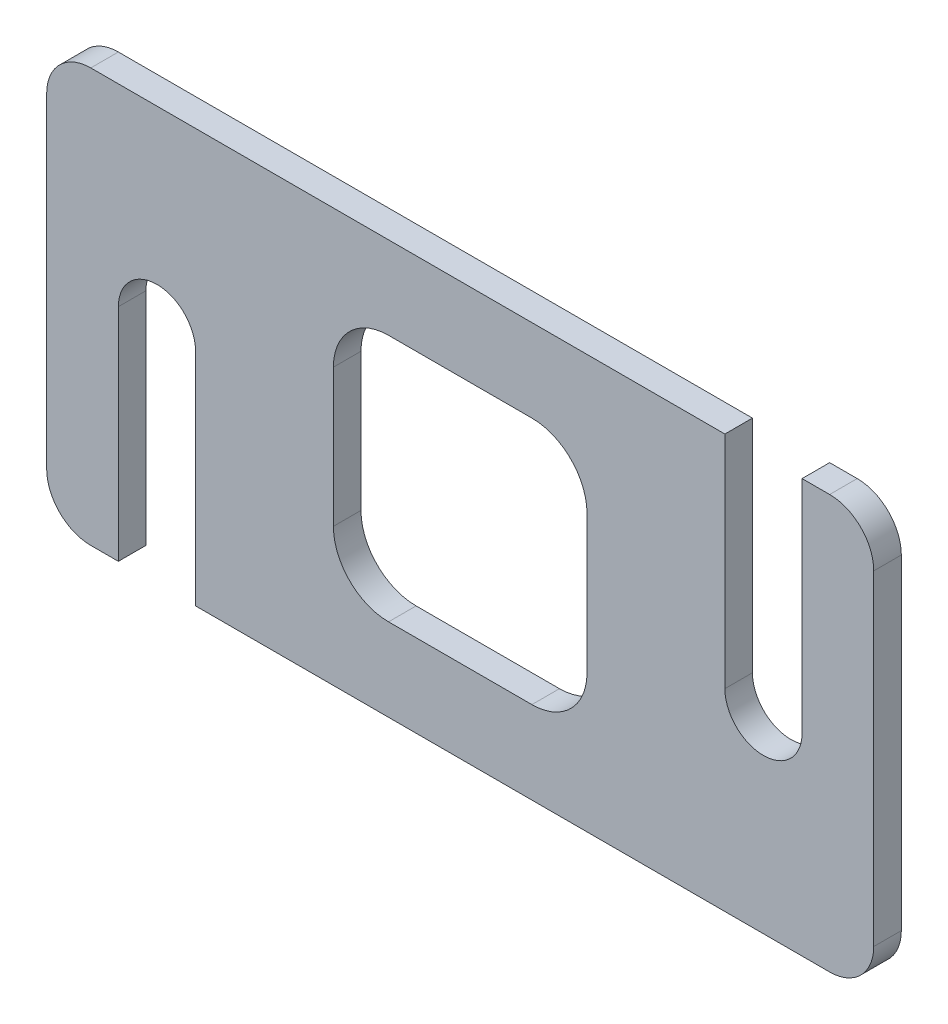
SolidWorks part; units mm, degrees
ref_plane "Front Plane" through (0, 0, 0) normal (0, 0, 1) x (1, 0, 0)
ref_plane "Top Plane" through (0, 0, 0) normal (0, 1, 0) x (1, 0, 0)
ref_plane "Right Plane" through (0, 0, 0) normal (1, 0, 0) x (0, 0, -1)
sketch "Sketch1" plane through (0, 0, 0) normal (0, 0, 1) x (1, 0, 0)
  line L1 (-75, -37.5) -> (75, -37.5)
  line L2 (-75, -37.5) -> (-75, 37.5)
  line L3 (-75, 37.5) -> (75, 37.5)
  line L4 (75, -37.5) -> (75, 37.5)
  line L5 (-75, -37.5) -> (75, 37.5) construction
  line L6 (-75, 37.5) -> (75, -37.5) construction
  point P0 (0, 0)
  dimension "D1" = 150
  dimension "D2" = 75
extrude "Boss-Extrude1" add sketch "Sketch1" along normal blind 5
sketch "Sketch2" plane through (0, 0, 5) normal (0, 0, 1) x (1, 0, 0)
  line L1 (-62, -37.5) -> (-48, -37.5)
  line L2 (-62, -37.5) -> (-62, 2.5)
  line L4 (-48, -37.5) -> (-48, 2.5)
  line L6 (-75, -37.5) -> (75, -37.5) construction
  line L7 (-75, 37.5) -> (-75, -37.5) construction
  arc A0 (-48, 2.5) -> (-62, 2.5) centre (-55, 2.5) ccw
  point P7 (-55, -37.5)
  dimension "D1" = 7
  dimension "D2" = 20
  dimension "D3" = 40
extrude "Cut-Extrude1" cut sketch "Sketch2" against normal through all
sketch "Sketch3" plane through (0, 0, 5) normal (0, 0, 1) x (1, 0, 0)
  line L1 (48, 37.5) -> (62, 37.5)
  line L2 (48, 37.5) -> (48, -2.5)
  line L4 (62, 37.5) -> (62, -2.5)
  line L6 (75, 37.5) -> (-75, 37.5) construction
  line L7 (75, -37.5) -> (75, 37.5) construction
  arc A0 (48, -2.5) -> (62, -2.5) centre (55, -2.5) ccw
  dimension "D1" = 7
  dimension "D2" = 20
  dimension "D3" = 40
extrude "Cut-Extrude2" cut sketch "Sketch3" against normal through all
sketch "Sketch4" plane through (0, 0, 5) normal (0, 0, 1) x (1, 0, 0)
  line L1 (-13, 22.5) -> (13, 22.5)
  line L2 (-23, 12.5) -> (-23, -12.5)
  line L3 (-13, -22.5) -> (13, -22.5)
  line L4 (23, 12.5) -> (23, -12.5)
  line L8 (-48, -37.5) -> (-48, 2.5) construction
  line L9 (48, 37.5) -> (48, -2.5) construction
  line L10 (48, 37.5) -> (-75, 37.5) construction
  line L11 (-48, -37.5) -> (75, -37.5) construction
  arc A0 (-13, 22.5) -> (-23, 12.5) centre (-13, 12.5) ccw
  arc A1 (-23, -12.5) -> (-13, -22.5) centre (-13, -12.5) ccw
  arc A2 (13, -22.5) -> (23, -12.5) centre (13, -12.5) ccw
  arc A3 (13, 22.5) -> (23, 12.5) centre (13, 12.5) cw
  dimension "D5" = 10
  dimension "D6" = 10
  dimension "D1" = 25
  dimension "D2" = 25
  dimension "D3" = 15
  dimension "D4" = 15
extrude "Cut-Extrude3" cut sketch "Sketch4" against normal through all
fillet "Fillet1" radius 8 4 edges at (-75, 37.5, 2.5) (75, 37.5, 2.5) (75, -37.5, 2.5) (-75, -37.5, 2.5)
